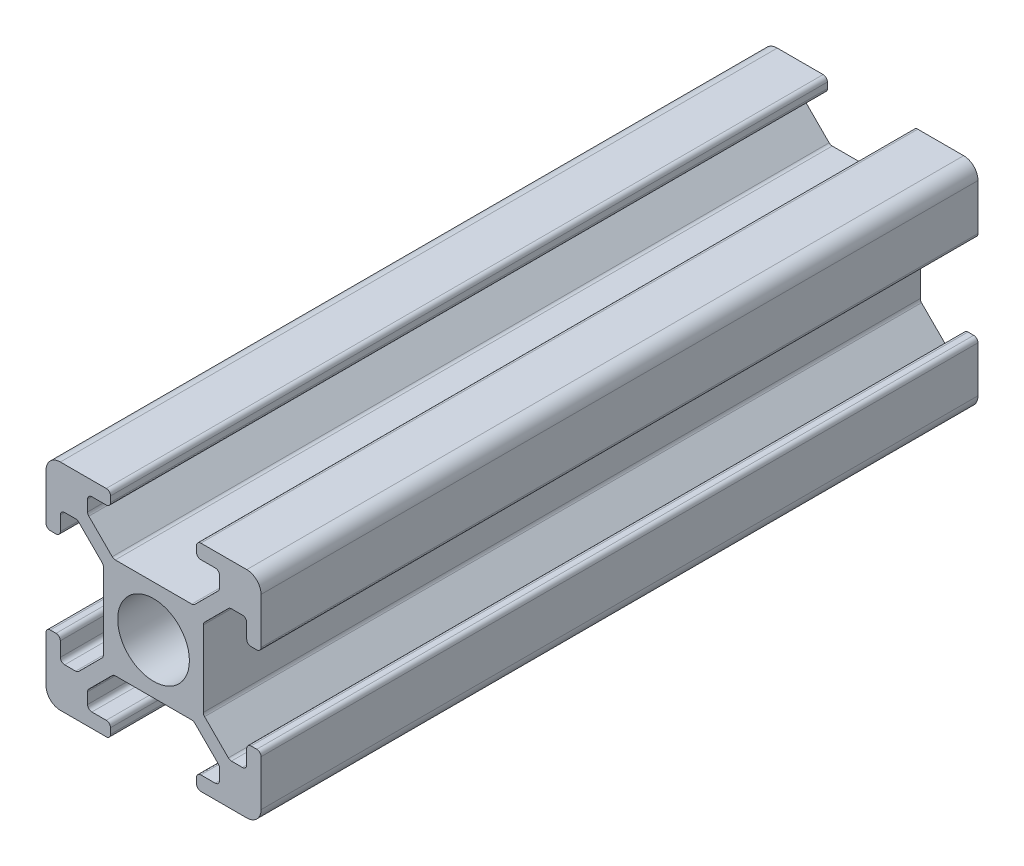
SolidWorks part; units mm, degrees
ref_plane "Front Plane" through (0, 0, 0) normal (0, 0, 1) x (1, 0, 0)
ref_plane "Top Plane" through (0, 0, 0) normal (0, 1, 0) x (1, 0, 0)
ref_plane "Right Plane" through (0, 0, 0) normal (1, 0, 0) x (0, 0, -1)
sketch "Sketch1" plane through (0, 0, 0) normal (0, 0, 1) x (1, 0, 0)
  line L0 (1, 0) -> (4.2, 0)
  line L1 (15, 1) -> (15, 4.2)
  line L2 (14, 15) -> (10.8, 15)
  line L3 (0, 14) -> (0, 10.8)
  line L4 (4.5, 0.3) -> (4.5, 0.7)
  line L5 (10.5, 0.3) -> (10.5, 0.7)
  line L6 (4.5, 14.7) -> (4.5, 14.3)
  line L7 (10.5, 14.7) -> (10.5, 14.3)
  line L8 (4.2, 15) -> (1, 15)
  line L9 (10.8, 0) -> (14, 0)
  line L10 (1, 4.2) -> (1, 3.2)
  line L11 (1, 10.8) -> (1, 11.8)
  line L12 (14.7, 10.5) -> (14.3, 10.5)
  line L13 (14.7, 4.5) -> (14.3, 4.5)
  line L14 (0.3, 4.5) -> (0.7, 4.5)
  line L15 (0.3, 10.5) -> (0.7, 10.5)
  line L16 (0, 4.2) -> (0, 1)
  line L17 (15, 10.8) -> (15, 14)
  line L18 (14, 10.8) -> (14, 11.8)
  line L19 (14, 4.2) -> (14, 3.2)
  line L20 (4.8314, 11) -> (10.1686, 11)
  line L21 (10.9728, 10.1414) -> (10.9728, 4.8586)
  line L22 (10.1686, 4) -> (4.8314, 4)
  line L23 (4, 4.8314) -> (4, 10.1686)
  line L24 (4.2, 14) -> (3.2, 14)
  line L25 (10.8, 14) -> (11.8, 14)
  line L26 (4.2, 1) -> (3.2, 1)
  line L27 (10.8, 1) -> (11.8, 1)
  line L28 (1.3, 12.1) -> (2.0686, 12.1)
  line L29 (2.9, 13.7) -> (2.9, 12.9314)
  line L30 (1.3, 2.9) -> (2.0686, 2.9)
  line L31 (2.9, 1.3) -> (2.9, 2.0686)
  line L32 (4.6192, 11.0879) -> (2.9879, 12.7192)
  line L33 (3.9121, 10.3808) -> (2.2808, 12.0121)
  line L34 (10.3808, 11.0879) -> (12.0121, 12.7192)
  line L35 (11.0607, 10.3536) -> (12.7192, 12.0121)
  line L36 (11.0607, 4.6464) -> (12.7192, 2.9879)
  line L37 (10.3808, 3.9121) -> (12.0121, 2.2808)
  line L38 (4.6192, 3.9121) -> (2.9879, 2.2808)
  line L39 (3.9121, 4.6192) -> (2.2808, 2.9879)
  line L40 (12.1, 13.7) -> (12.1, 12.9314)
  line L41 (13.7, 12.1) -> (12.9314, 12.1)
  line L42 (13.7, 2.9) -> (12.9314, 2.9)
  line L43 (12.1, 1.3) -> (12.1, 2.0686)
  circle A0 centre (7.5, 7.5) radius 2.5
  arc A1 (1, 0) -> (0, 1) centre (1, 1) cw
  arc A2 (14, 0) -> (15, 1) centre (14, 1) ccw
  arc A3 (15, 14) -> (14, 15) centre (14, 14) ccw
  arc A4 (1, 15) -> (0, 14) centre (1, 14) ccw
  arc A5 (10.5, 0.3) -> (10.8, 0) centre (10.8, 0.3) ccw
  arc A6 (10.5, 0.7) -> (10.8, 1) centre (10.8, 0.7) cw
  arc A7 (4.5, 0.3) -> (4.2, 0) centre (4.2, 0.3) cw
  arc A8 (4.5, 0.7) -> (4.2, 1) centre (4.2, 0.7) ccw
  arc A9 (0.7, 4.5) -> (1, 4.2) centre (0.7, 4.2) cw
  arc A10 (0.3, 4.5) -> (0, 4.2) centre (0.3, 4.2) ccw
  arc A11 (0.7, 10.5) -> (1, 10.8) centre (0.7, 10.8) ccw
  arc A12 (0.3, 10.5) -> (0, 10.8) centre (0.3, 10.8) cw
  arc A13 (4.5, 14.3) -> (4.2, 14) centre (4.2, 14.3) cw
  arc A14 (4.2, 15) -> (4.5, 14.7) centre (4.2, 14.7) cw
  arc A15 (10.5, 14.3) -> (10.8, 14) centre (10.8, 14.3) ccw
  arc A16 (10.8, 15) -> (10.5, 14.7) centre (10.8, 14.7) ccw
  arc A17 (14.3, 4.5) -> (14, 4.2) centre (14.3, 4.2) ccw
  arc A18 (15, 4.2) -> (14.7, 4.5) centre (14.7, 4.2) ccw
  arc A19 (14.3, 10.5) -> (14, 10.8) centre (14.3, 10.8) cw
  arc A20 (15, 10.8) -> (14.7, 10.5) centre (14.7, 10.8) cw
  arc A21 (11.8, 14) -> (12.1, 13.7) centre (11.8, 13.7) cw
  arc A22 (14, 11.8) -> (13.7, 12.1) centre (13.7, 11.8) ccw
  arc A23 (14, 3.2) -> (13.7, 2.9) centre (13.7, 3.2) cw
  arc A24 (11.8, 1) -> (12.1, 1.3) centre (11.8, 1.3) ccw
  arc A25 (3.2, 1) -> (2.9, 1.3) centre (3.2, 1.3) cw
  arc A26 (1, 3.2) -> (1.3, 2.9) centre (1.3, 3.2) ccw
  arc A27 (1, 11.8) -> (1.3, 12.1) centre (1.3, 11.8) cw
  arc A28 (3.2, 14) -> (2.9, 13.7) centre (3.2, 13.7) ccw
  arc A29 (10.3808, 11.0879) -> (10.1686, 11) centre (10.1686, 11.3) cw
  arc A30 (12.1, 12.9314) -> (12.0121, 12.7192) centre (11.8, 12.9314) cw
  arc A31 (4.6192, 11.0879) -> (4.8314, 11) centre (4.8314, 11.3) ccw
  arc A32 (12.9314, 12.1) -> (12.7192, 12.0121) centre (12.9314, 11.8) ccw
  arc A33 (11.0607, 10.3536) -> (10.9728, 10.1414) centre (11.2728, 10.1414) ccw
  arc A34 (11.0607, 4.6464) -> (10.9728, 4.8586) centre (11.2728, 4.8586) cw
  arc A35 (12.9314, 2.9) -> (12.7192, 2.9879) centre (12.9314, 3.2) cw
  arc A36 (12.1, 2.0686) -> (12.0121, 2.2808) centre (11.8, 2.0686) ccw
  arc A37 (2.9, 2.0686) -> (2.9879, 2.2808) centre (3.2, 2.0686) cw
  arc A38 (10.3808, 3.9121) -> (10.1686, 4) centre (10.1686, 3.7) ccw
  arc A39 (4.6192, 3.9121) -> (4.8314, 4) centre (4.8314, 3.7) cw
  arc A40 (2.0686, 2.9) -> (2.2808, 2.9879) centre (2.0686, 3.2) ccw
  arc A41 (3.9121, 4.6192) -> (4, 4.8314) centre (3.7, 4.8314) ccw
  arc A42 (3.9121, 10.3808) -> (4, 10.1686) centre (3.7, 10.1686) cw
  arc A43 (2.9, 12.9314) -> (2.9879, 12.7192) centre (3.2, 12.9314) ccw
  arc A44 (2.0686, 12.1) -> (2.2808, 12.0121) centre (2.0686, 11.8) cw
  point P2 (0, 0)
  dimension "D1" = 15
extrude "Boss-Extrude1" add sketch "Sketch1" along normal blind 50
